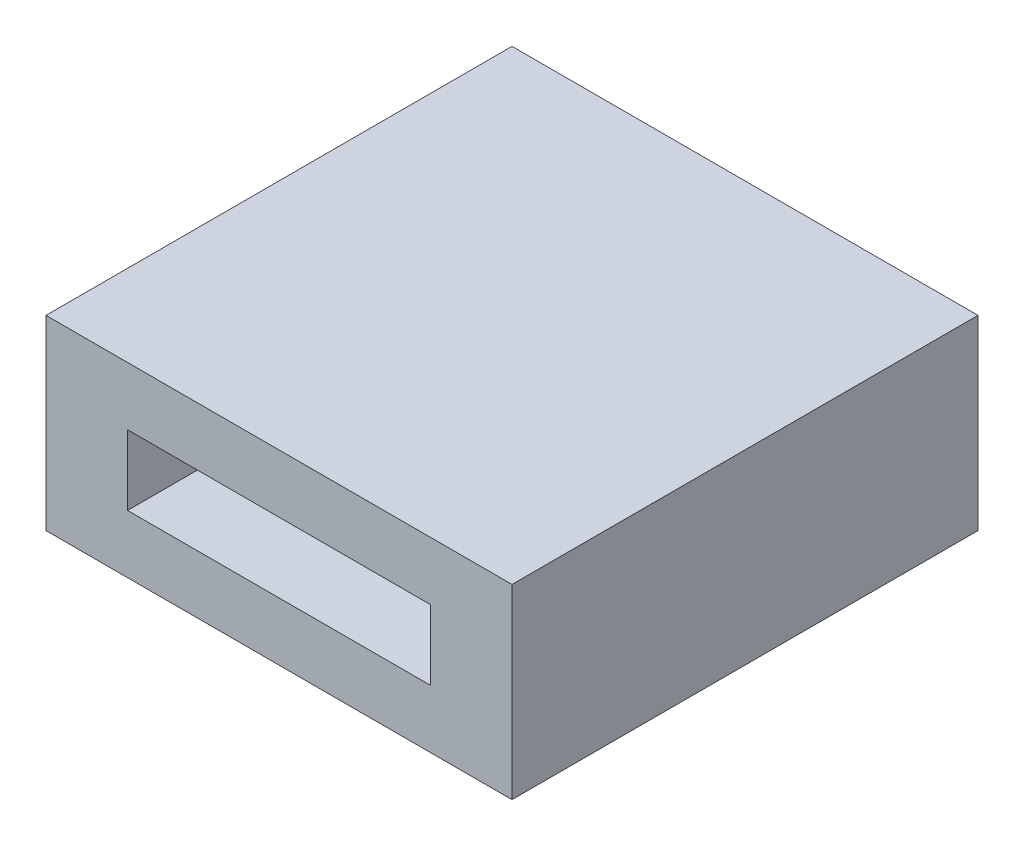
SolidWorks part; units mm, degrees
ref_plane "Front Plane" through (0, 0, 0) normal (0, 0, 1) x (1, 0, 0)
ref_plane "Top Plane" through (0, 0, 0) normal (0, 1, 0) x (1, 0, 0)
ref_plane "Right Plane" through (0, 0, 0) normal (1, 0, 0) x (0, 0, -1)
sketch "Sketch1" plane through (0, 0, 0) normal (0, 0, 1) x (1, 0, 0)
  line L1 (-17.76, 2.032) -> (-12.68, 2.032)
  line L2 (-17.76, 2.032) -> (-17.76, 0)
  line L3 (-17.76, 0) -> (-12.68, 0)
  line L4 (-12.68, 2.032) -> (-12.68, 0)
  dimension "D1" = 5.08
  dimension "D2" = 2.032
extrude "Extrude1" add sketch "Sketch1" along normal blind 5.08
sketch "Sketch2" plane through (0, 0, 5.08) normal (0, 0, 1) x (1, 0, 0)
  line L0 (-12.68, 2.032) -> (-17.76, 2.032) construction
  line L1 (-16.871, 1.397) -> (-13.569, 1.397)
  line L2 (-16.871, 1.397) -> (-16.871, 0.635)
  line L3 (-16.871, 0.635) -> (-13.569, 0.635)
  line L4 (-13.569, 1.397) -> (-13.569, 0.635)
  line L5 (-17.76, 2.032) -> (-17.76, 0) construction
  dimension "D1" = 0.762
  dimension "D2" = 0.635
  dimension "D3" = 3.302
  dimension "D4" = 0.889
extrude "Cut-Extrude1" cut sketch "Sketch2" against normal blind 4.572
